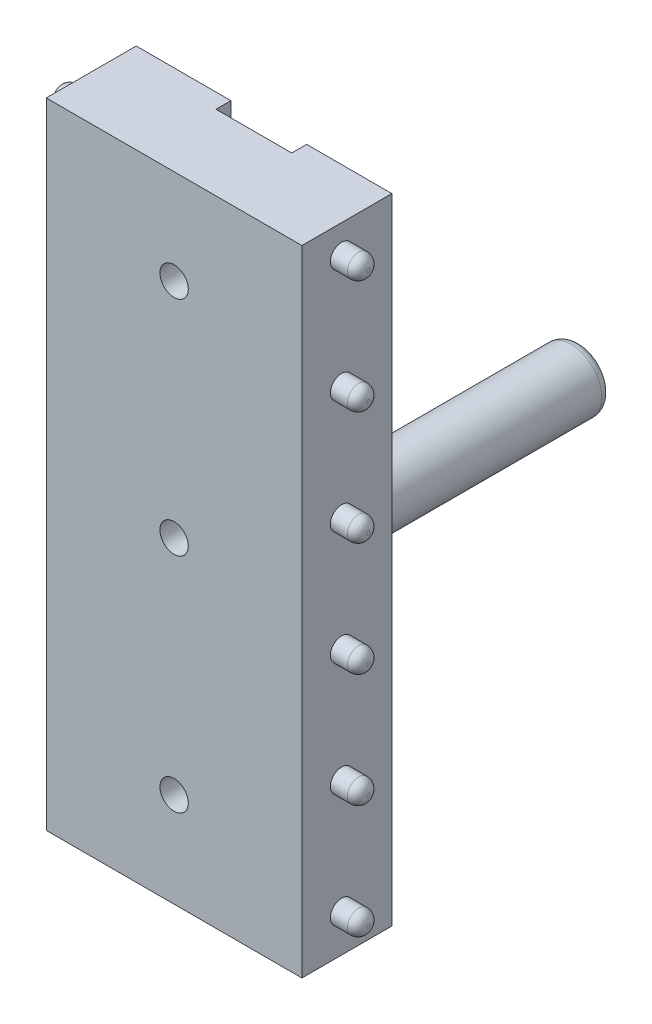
SolidWorks part; units mm, degrees
ref_plane "Plan de face" through (0, 0, 0) normal (0, 0, 1) x (1, 0, 0)
ref_plane "Plan de dessus" through (0, 0, 0) normal (0, 1, 0) x (1, 0, 0)
ref_plane "Plan de droite" through (0, 0, 0) normal (1, 0, 0) x (0, 0, -1)
sketch "Esquisse1" plane through (0, 0, 0) normal (0, 1, 0) x (1, 0, 0)
  line L0 (14, 9.5) -> (14, 4.7904) construction
  line L1 (0, 0) -> (27, 0)
  line L2 (0, 0) -> (0, 9.5)
  line L3 (18, 9.5) -> (27, 9.5)
  line L4 (27, 0) -> (27, 9.5)
  line L5 (18, 9.5) -> (18, 7.9281)
  line L6 (18, 7.9281) -> (10, 7.9281)
  line L7 (10, 7.9281) -> (10, 9.5)
  line L9 (0, 9.5) -> (10, 9.5)
  dimension "D1" = 27
  dimension "D2" = 9.5
  dimension "D3" = 4
  dimension "D4" = 8
  dimension "D5" = 13
extrude "Extrusion1" add sketch "Esquisse1" along normal blind 67
sketch "Esquisse2" plane through (0, 0, -7.9281) normal (0, 0, -1) x (-1, 0, 0)
  line L0 (-27, 27) -> (0, 27) construction
  line L1 (-18, 67) -> (-10, 67) construction
  line L2 (-27, 67) -> (-27, 0) construction
  line L3 (0, 67) -> (0, 0) construction
  circle A0 centre (-13.5, 27) radius 3.25
  dimension "D2" = 6.5
  dimension "D1" = 40
extrude "Extrusion2" add sketch "Esquisse2" along normal blind 35
ref_plane "Plan1" through (13.5, 0, 0) normal (1, 0, 0) x (0, 0, -1)
sketch "Esquisse3" plane through (27, 0, 0) normal (1, 0, 0) x (0, 0, -1)
  line L0 (0, 67) -> (0, 0) construction
  line L1 (0, 67) -> (9.5, 67) construction
  circle A0 centre (4.2, 64) radius 1.2
  circle A1 centre (4.2, 52) radius 1.2
  circle A2 centre (4.2, 40) radius 1.2
  circle A3 centre (4.2, 28) radius 1.2
  circle A4 centre (4.2, 16) radius 1.2
  circle A5 centre (4.2, 4) radius 1.2
  dimension "D1" = 4.2
  dimension "D2" = 3
  dimension "D3" = 2.4
extrude "Extrusion3" add sketch "Esquisse3" along normal blind 2.8
fillet "Congé1" radius 1 1 edges at (10.25, 27, -42.9281)
fillet "Congé2" radius 1 6 edges at (29.8, 64, -5.4) (29.8, 52, -5.4) (29.8, 40, -5.4) (29.8, 28, -5.4) (29.8, 16, -5.4) (29.8, 4, -5.4)
mirror "Symétrie1" about plane through (13.5, 0, 0) normal (1, 0, 0) of "Congé2", "Extrusion3"
sketch "Esquisse5" plane through (0, 0, 0) normal (0, 0, 1) x (1, 0, 0)
  line L0 (13.5, 67) -> (13.5, 0) construction
  line L1 (0, 67) -> (27, 67) construction
  line L2 (0, 0) -> (27, 0) construction
  circle A0 centre (13.5, 57) radius 1.5
  circle A1 centre (13.5, 10) radius 1.5
  circle A2 centre (13.5, 33.5) radius 1.5
  dimension "D1" = 10
  dimension "D2" = 10
  dimension "D3" = 33.5
extrude "Enlèv. mat.-Extru.1" cut sketch "Esquisse5" against normal blind 10
